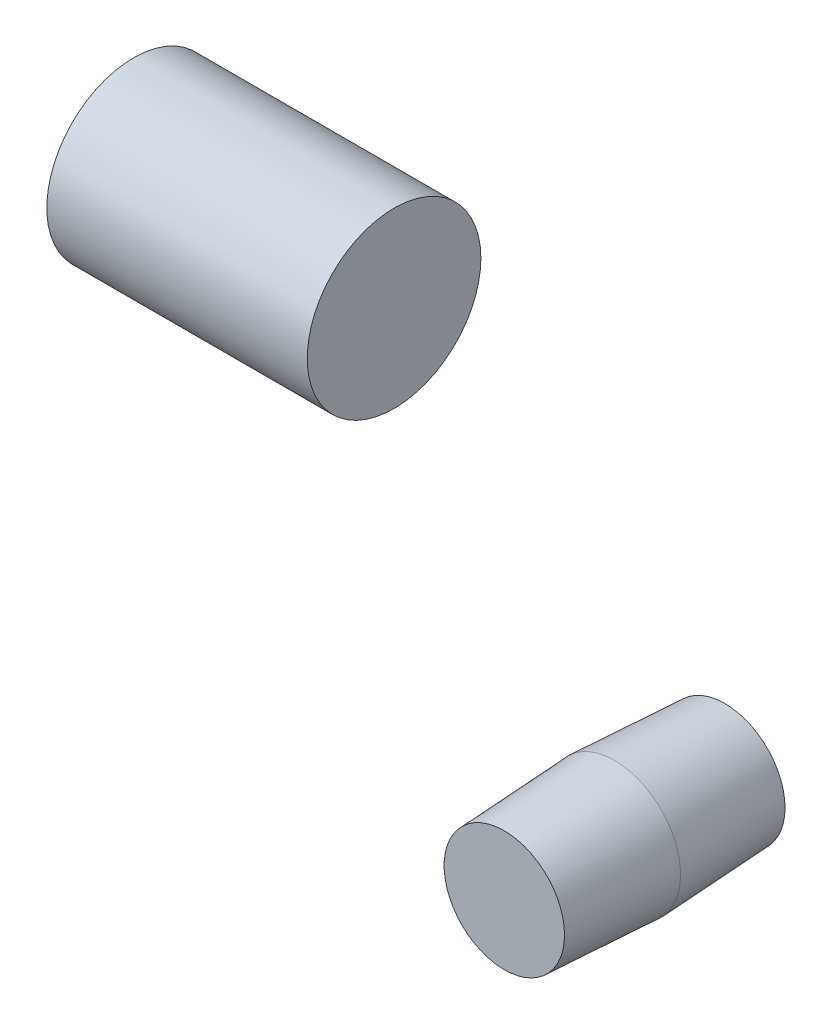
SolidWorks part; units mm, degrees
ref_plane "Front Plane" through (0, 0, 0) normal (0, 0, 1) x (1, 0, 0)
ref_plane "Top Plane" through (0, 0, 0) normal (0, 1, 0) x (1, 0, 0)
ref_plane "Right Plane" through (0, 0, 0) normal (1, 0, 0) x (0, 0, -1)
sketch "Sketch1" plane through (0, 0, 0) normal (0, 0, 1) x (1, 0, 0)
  circle A0 centre (0, 0) radius 19
  dimension "D1" = 38
extrude "Boss-Extrude1" add sketch "Sketch1" along normal mid plane 63.5 draft 3
sketch "Sketch2" plane through (0, 0, 0) normal (1, 0, 0) x (0, 0, -1)
  circle A0 centre (0, 100) radius 25
  dimension "D1" = 50
  dimension "D2" = 100
extrude "Boss-Extrude2" add sketch "Sketch2" against normal blind 75 from offset 63.5 separate body
sketch "Sweep Curves" plane through (0, 0, 0) normal (0, 0, 1) x (1, 0, 0)
  line L0 (-63.5, 100) -> (-138.5, 100) construction
  line L1 (-63.5, 75) -> (-63.5, 125) construction
  line L2 (-138.5, 125) -> (-138.5, 75) construction
  line L3 (0, 19) -> (0, -19) construction
  line L4 (-75.5, 100) -> (-75.5, 39)
  line L5 (-55.5, 19) -> (0, 19)
  line L6 (-132.5, 100) -> (-132.5, 47)
  line L7 (-66.5, -19) -> (0, -19)
  line L8 (-138.5, 100) -> (-63.5, 100) construction
  arc A1 (-75.5, 39) -> (-55.5, 19) centre (-55.5, 39) ccw
  arc A2 (-132.5, 47) -> (-66.5, -19) centre (-66.5, 47) ccw
  circle A4 centre (0, 0) radius 19 construction
  dimension "D3" = 20
  dimension "D4" = 66
  dimension "D1" = 57
  dimension "D2" = 12
ref_plane "Plane1" through (0, 100, 0) normal (0, 1, 0) x (1, 0, 0)
sketch "Sketch4" plane through (0, 100, 0) normal (0, 1, 0) x (1, 0, 0)
  line L0 (-75.5, 0) -> (-132.5, 0) construction
  line L1 (-132.5, 0) -> (-132.1856, 6)
  line L2 (-132.1856, 6) -> (-89.8059, 6)
  line L3 (-89.8059, 6) -> (-88.8102, 25)
  line L4 (-88.8102, 25) -> (-76.8102, 25)
  line L5 (-76.8102, 25) -> (-75.5, 0)
  line L6 (-132.5, 0) -> (-132.5, 50.6714) construction
  line L7 (-89.8059, 6) -> (-89.8059, 44.4606) construction
  line L8 (-75.5, 0) -> (-75.5, 48.2677) construction
  line L9 (-76.8102, -25) -> (-75.5, 0)
  line L10 (-88.8102, -25) -> (-76.8102, -25)
  line L11 (-89.8059, -6) -> (-88.8102, -25)
  line L12 (-132.1856, -6) -> (-89.8059, -6)
  line L13 (-132.5, 0) -> (-132.1856, -6)
  dimension "D1" = 3
  dimension "D2" = 3
  dimension "D3" = 3
  dimension "D4" = 50
  dimension "D5" = 12
  dimension "D6" = 12
